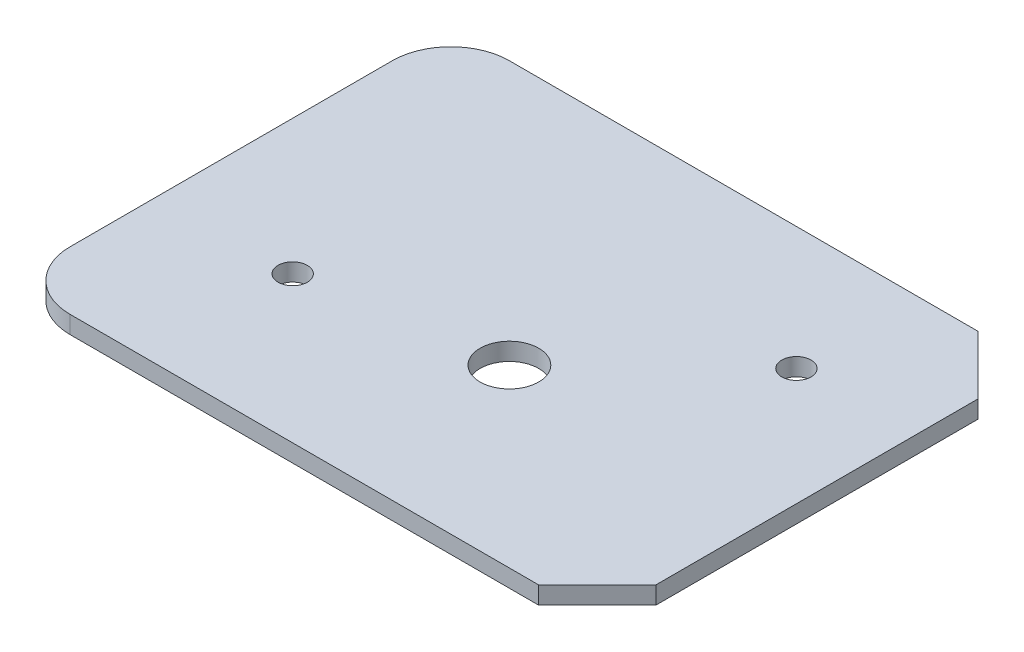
SolidWorks part; units mm, degrees
ref_plane "Front" through (0, 0, 0) normal (0, 0, 1) x (1, 0, 0)
ref_plane "Top" through (0, 0, 0) normal (0, 1, 0) x (1, 0, 0)
ref_plane "Right" through (0, 0, 0) normal (1, 0, 0) x (0, 0, -1)
sketch "Sketch1" plane through (0, 0, 0) normal (0, 1, 0) x (1, 0, 0)
  line L1 (10, 0) -> (90, 0)
  line L2 (0, 10) -> (0, 65)
  line L3 (10, 75) -> (90, 75)
  line L4 (100, 10) -> (100, 65)
  line L14 (90, 75) -> (100, 65)
  line L15 (100, 10) -> (90, 0)
  arc A0 (0, 65) -> (10, 75) centre (10, 65) cw
  arc A1 (10, 0) -> (0, 10) centre (10, 10) cw
  circle A2 centre (80, 54) radius 2.5
  circle A3 centre (55, 30) radius 5
  circle A4 centre (23, 25) radius 2.5
extrude "Extrude1" add sketch "Sketch1" along normal blind 3
